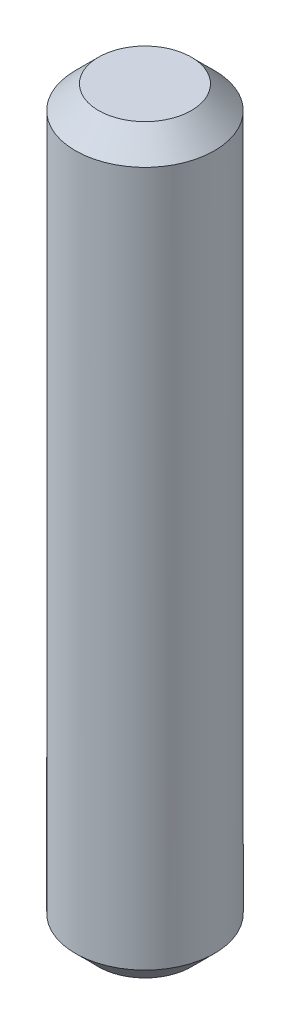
SolidWorks part; units mm, degrees
ref_plane "Front" through (0, 0, 0) normal (0, 0, 1) x (1, 0, 0)
ref_plane "Top" through (0, 0, 0) normal (0, 1, 0) x (1, 0, 0)
ref_plane "Right" through (0, 0, 0) normal (1, 0, 0) x (0, 0, -1)
sketch "Sketch1" plane through (0, 0, 0) normal (0, 0, 1) x (1, 0, 0)
  line L0 (0, 14.134) -> (0, -8.6107) construction
  line L1 (0, 8) -> (0.75, 8)
  line L2 (0, 8) -> (0, 0)
  line L3 (0, 0) -> (0.75, 0)
  line L4 (0.75, 8) -> (0.75, 0)
  dimension "D1" = 0.75
  dimension "D2" = 8
revolve "Revolve1" add sketch "Sketch1" angle 360 about L0
chamfer "Chamfer1" distance 0.25 angle 45
